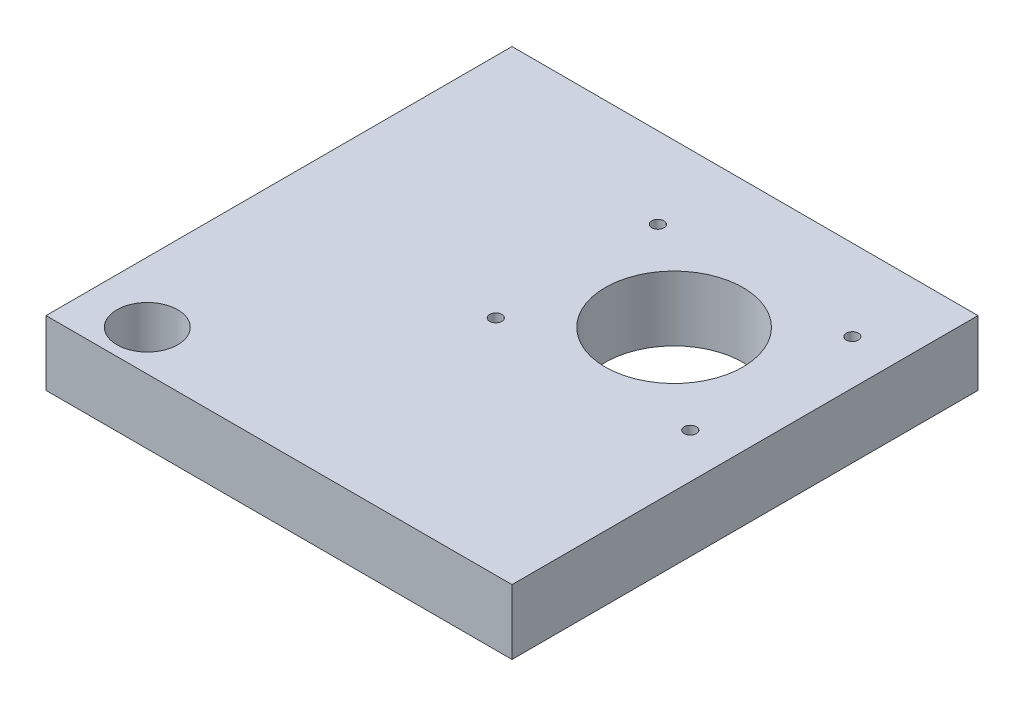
SolidWorks part; units mm, degrees
ref_plane "Face" through (0, 0, 0) normal (0, 0, 1) x (1, 0, 0)
ref_plane "Dessus" through (0, 0, 0) normal (0, 1, 0) x (1, 0, 0)
ref_plane "Droite" through (0, 0, 0) normal (1, 0, 0) x (0, 0, -1)
sketch "Esquisse1" plane through (0, 0, 0) normal (0, 0, 1) x (1, 0, 0)
  line L1 (0, 0) -> (115, 0)
  line L2 (0, 0) -> (0, 16)
  line L3 (0, 16) -> (115, 16)
  line L4 (115, 0) -> (115, 16)
  dimension "D1" = 115
  dimension "D2" = 16
extrude "Base-Extrusion" add sketch "Esquisse1" along normal blind 115
sketch "Esquisse2" plane through (0, 16, 0) normal (0, 1, 0) x (-1, 0, 0)
  line L0 (0, 40) -> (-140, 40) construction
  line L1 (0, 115) -> (0, 0) construction
  line L2 (-115, 0) -> (0, 0) construction
  line L3 (-80, 115) -> (-80, -14.6321) construction
  line L4 (-115, 115) -> (0, 115) construction
  circle A0 centre (-80, 40) radius 17
  dimension "D2" = 34
  dimension "D1" = 80
  dimension "D3" = 40
extrude "Enlèv. mat.-Extru.1" cut sketch "Esquisse2" against normal through all
sketch "Esquisse3" plane through (0, 16, 0) normal (0, 1, 0) x (-1, 0, 0)
  line L0 (-80, -17.4944) -> (-80, 40) construction
  line L1 (-104, -15.623) -> (-104, 103.9405) construction
  line L2 (-56, -19.9897) -> (-56, 106.8516) construction
  line L3 (-69.8111, 60) -> (-7.0143, 60) construction
  line L4 (-69.8111, 20) -> (-6.9974, 20) construction
  circle A0 centre (-80, 40) radius 17 construction
  circle A1 centre (-104, 20) radius 1.5
  circle A2 centre (-104, 60) radius 1.5
  circle A3 centre (-56, 60) radius 1.5
  circle A4 centre (-56, 20) radius 1.5
  dimension "D5" = 3
  dimension "D1" = 20
  dimension "D2" = 20
  dimension "D3" = 24
  dimension "D4" = 24
extrude "Enlèv. mat.-Extru.2" cut sketch "Esquisse3" against normal through all
sketch "Esquisse4" plane through (0, 16, 0) normal (0, 1, 0) x (-1, 0, 0)
  line L0 (0, 115) -> (0, 0) construction
  line L1 (-115, 115) -> (0, 115) construction
  circle A0 centre (-15, 105) radius 7.5
  dimension "D1" = 15
  dimension "D2" = 15
  dimension "D3" = 10
extrude "Enlèv. mat.-Extru.3" cut sketch "Esquisse4" against normal through all
sketch "Esquisse6" plane through (0, 16, 0) normal (0, 1, 0) x (-1, 0, 0)
  line L0 (-80, 40) -> (-144, 40) construction
  circle A0 centre (-80, 40) radius 17 construction
  point P4 (-144, 40)
  dimension "D1" = 64
